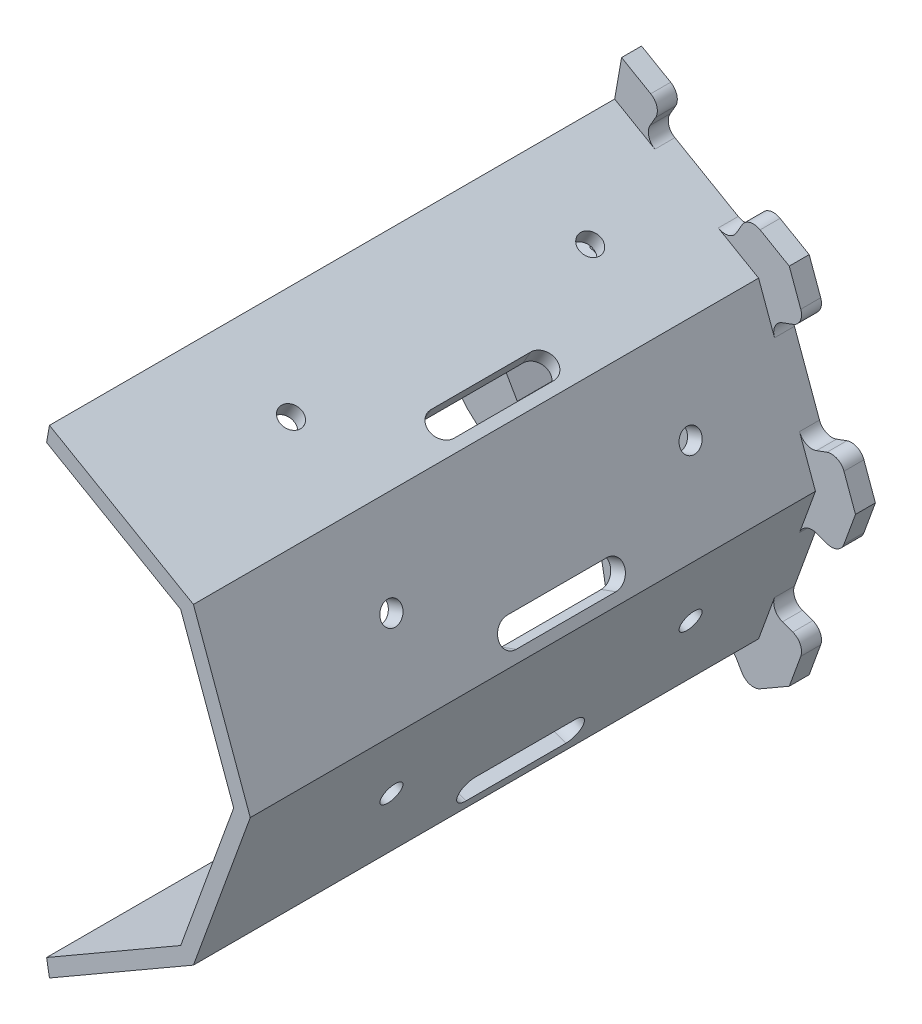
SolidWorks part; units mm, degrees
ref_plane "Front Plane" through (0, 0, 0) normal (0, 0, 1) x (1, 0, 0)
ref_plane "Top Plane" through (0, 0, 0) normal (0, 1, 0) x (1, 0, 0)
ref_plane "Right Plane" through (0, 0, 0) normal (1, 0, 0) x (0, 0, -1)
sketch "Sketch1" plane through (0, 0, 0) normal (0, 0, 1) x (1, 0, 0)
  line L1 (36.5476, 0) -> (27.9971, 23.4923)
  line L2 (27.9971, 23.4923) -> (6.3464, 35.9923)
  line L3 (6.3464, 35.9923) -> (-18.2738, 31.6511)
  line L4 (-18.2738, 31.6511) -> (-34.3435, 12.5)
  line L5 (-34.3435, 12.5) -> (-34.3435, -12.5)
  line L6 (-34.3435, -12.5) -> (-18.2738, -31.6511)
  line L7 (-18.2738, -31.6511) -> (6.3464, -35.9923)
  line L8 (6.3464, -35.9923) -> (27.9971, -23.4923)
  line L9 (27.9971, -23.4923) -> (36.5476, 0)
  circle A0 centre (0, 0) radius 34.3435 construction
extrude "Boss-Extrude1" add sketch "Sketch1" along normal blind 85
sketch "Sketch2" plane through (0, 0, 85) normal (0, 0, 1) x (1, 0, 0)
  line L1 (34.0537, 0) -> (26.0866, 21.8893)
  line L2 (26.0866, 21.8893) -> (5.9134, 33.5363)
  line L3 (5.9134, 33.5363) -> (-17.0268, 29.4914)
  line L4 (-17.0268, 29.4914) -> (-32, 11.647)
  line L5 (-32, 11.647) -> (-32, -11.647)
  line L6 (-32, -11.647) -> (-17.0268, -29.4914)
  line L7 (-17.0268, -29.4914) -> (5.9134, -33.5363)
  line L8 (5.9134, -33.5363) -> (26.0866, -21.8893)
  line L9 (26.0866, -21.8893) -> (34.0537, 0)
  circle A0 centre (0, 0) radius 32 construction
extrude "Cut-Extrude1" cut sketch "Sketch2" against normal through all
sketch "Sketch3" plane through (17.1717, 29.7423, 0) normal (0.5, 0.866, 0) x (0.866, -0.5, 0)
  circle A0 centre (0, -14.5) radius 1.65
  circle A1 centre (0, -59.5) radius 1.65
extrude "Cut-Extrude2" cut sketch "Sketch3" against normal up to next
sketch "Sketch4" plane through (32.2723, 11.7462, 0) normal (0.9397, 0.342, 0) x (0, 0, -1)
  circle A0 centre (-14.5, 0) radius 1.65
  circle A1 centre (-59.5, 0) radius 1.65
extrude "Cut-Extrude6" cut sketch "Sketch4" against normal up to next
sketch "Sketch5" plane through (32.2723, -11.7462, 0) normal (0.9397, -0.342, 0) x (0, 0, -1)
  circle A0 centre (-14.5, 0) radius 1.65
  circle A1 centre (-59.5, 0) radius 1.65
extrude "Cut-Extrude7" cut sketch "Sketch5" against normal up to next
sketch "Sketch6" plane through (17.1717, -29.7423, 0) normal (0.5, -0.866, 0) x (0.866, 0.5, 0)
  circle A0 centre (0, 14.5) radius 1.65
  circle A1 centre (0, 59.5) radius 1.65
extrude "Cut-Extrude8" cut sketch "Sketch6" against normal up to next
sketch "Sketch7" plane through (0, 0, 0) normal (0, 0, -1) x (-1, 0, 0)
  line L1 (40, 14.5588) -> (21.2836, 36.8642)
  line L2 (21.2836, 36.8642) -> (-7.3917, 41.9204)
  line L3 (-7.3917, 41.9204) -> (-32.6083, 27.3616)
  line L4 (-32.6083, 27.3616) -> (-42.5671, 0)
  line L5 (-42.5671, 0) -> (-32.6083, -27.3616)
  line L6 (-32.6083, -27.3616) -> (-7.3917, -41.9204)
  line L7 (-7.3917, -41.9204) -> (21.2836, -36.8642)
  line L8 (21.2836, -36.8642) -> (40, -14.5588)
  line L9 (40, -14.5588) -> (40, 14.5588)
  circle A0 centre (0, 0) radius 40 construction
extrude "Boss-Extrude2" add sketch "Sketch7" along normal blind 3
sketch "Sketch8" plane through (0, 0, 0) normal (0, 0, 1) x (1, 0, 0)
  circle A0 centre (0, 0) radius 15
extrude "Boss-Extrude3" add sketch "Sketch8" along normal blind 5
sketch "Sketch9" plane through (0, 0, 5) normal (0, 0, 1) x (1, 0, 0)
  line L1 (6.58, 0) -> (3.29, 5.6984)
  line L2 (3.29, 5.6984) -> (-3.29, 5.6984)
  line L3 (-3.29, 5.6984) -> (-6.58, 0)
  line L4 (-6.58, 0) -> (-3.29, -5.6984)
  line L5 (-3.29, -5.6984) -> (3.29, -5.6984)
  line L6 (3.29, -5.6984) -> (6.58, 0)
  circle A0 centre (0, 0) radius 5.6984 construction
extrude "Cut-Extrude9" cut sketch "Sketch9" against normal blind 6
sketch "Sketch10" plane through (0, 0, -1) normal (0, 0, 1) x (1, 0, 0)
  circle A0 centre (0, 0) radius 3.5
extrude "Cut-Extrude10" cut sketch "Sketch10" against normal up to next
sketch "Sketch12" plane through (0, 0, 0) normal (0, 0, 1) x (1, 0, 0)
  line L1 (7.3917, 41.9204) -> (32.6083, 27.3616) construction
  line L2 (26.4952, 30.891) -> (23.6669, 25.9923)
  line L3 (27.9971, 23.4923) -> (6.3464, 35.9923) construction
  line L4 (23.6669, 25.9923) -> (10.6765, 33.4923)
  line L5 (27.9971, 23.4923) -> (6.3464, 35.9923) construction
  line L6 (10.6765, 33.4923) -> (13.5048, 38.391)
  line L7 (13.5048, 38.391) -> (26.4952, 30.891)
extrude "Cut-Extrude12" cut sketch "Sketch12" against normal up to next
fillet "Fillet1" radius 2 4 edges at (13.5048, 38.391, -1.5) (10.6765, 33.4923, -1.5) (26.4952, 30.891, -1.5) (23.6669, 25.9923, -1.5)
sketch "Sketch13" plane through (0, 0, 0) normal (0, 0, 1) x (1, 0, 0)
  line L1 (32.6083, 27.3616) -> (42.5671, 0) construction
  line L2 (40.1529, 6.6331) -> (34.8375, 4.6985)
  line L3 (36.5476, 0) -> (27.9971, 23.4923) construction
  line L4 (34.8375, 4.6985) -> (29.7072, 18.7939)
  line L5 (29.7072, 18.7939) -> (35.0226, 20.7285)
  line L6 (35.0226, 20.7285) -> (40.1529, 6.6331)
extrude "Cut-Extrude13" cut sketch "Sketch13" against normal up to next
sketch "Sketch14" plane through (0, 0, 0) normal (0, 0, 1) x (1, 0, 0)
  line L0 (37.5877, -13.6808) -> (35.0226, -20.7285)
  line L1 (42.5671, 0) -> (32.6083, -27.3616) construction
  line L2 (35.0226, -20.7285) -> (29.7072, -18.7939)
  line L3 (27.9971, -23.4923) -> (36.5476, 0) construction
  line L4 (29.7072, -18.7939) -> (34.8375, -4.6985)
  line L5 (27.9971, -23.4923) -> (36.5476, 0) construction
  line L6 (34.8375, -4.6985) -> (40.1529, -6.6331)
  line L7 (40.1529, -6.6331) -> (37.5877, -13.6808)
extrude "Cut-Extrude14" cut sketch "Sketch14" against normal up to next
sketch "Sketch15" plane through (0, 0, 0) normal (0, 0, 1) x (1, 0, 0)
  line L0 (20, -34.641) -> (13.5048, -38.391)
  line L1 (32.6083, -27.3616) -> (7.3917, -41.9204) construction
  line L2 (13.5048, -38.391) -> (10.6765, -33.4923)
  line L3 (6.3464, -35.9923) -> (27.9971, -23.4923) construction
  line L4 (10.6765, -33.4923) -> (23.6669, -25.9923)
  line L5 (6.3464, -35.9923) -> (27.9971, -23.4923) construction
  line L6 (23.6669, -25.9923) -> (26.4952, -30.891)
  line L7 (26.4952, -30.891) -> (20, -34.641)
extrude "Cut-Extrude15" cut sketch "Sketch15" against normal up to next
fillet "Fillet2" radius 2 12 edges at (13.5048, -38.391, -1.5) (10.6765, -33.4923, -1.5) (23.6669, -25.9923, -1.5) (26.4952, -30.891, -1.5) (35.0226, -20.7285, -1.5) (29.7072, -18.7939, -1.5) (34.8375, -4.6985, -1.5) (40.1529, -6.6331, -1.5) (40.1529, 6.6331, -1.5) (34.8375, 4.6985, -1.5) (29.7072, 18.7939, -1.5) (35.0226, 20.7285, -1.5)
sketch "Sketch16" plane through (17.1717, 29.7423, 0) normal (0.5, 0.866, 0) x (0.866, -0.5, 0)
  line L0 (9, -44.5) -> (9, -29.5) construction
  line L1 (7, -44.5) -> (7, -29.5)
  line L2 (11, -44.5) -> (11, -29.5)
  arc A0 (7, -44.5) -> (11, -44.5) centre (9, -44.5) ccw
  arc A1 (11, -29.5) -> (7, -29.5) centre (9, -29.5) ccw
  point P2 (9, -37)
extrude "Cut-Extrude16" cut sketch "Sketch16" against normal up to next
sketch "Sketch17" plane through (32.2723, 11.7462, 0) normal (0.9397, 0.342, 0) x (0, 0, -1)
  line L0 (-44.5, -9) -> (-29.5, -9) construction
  line L1 (-44.5, -7) -> (-29.5, -7)
  line L2 (-44.5, -11) -> (-29.5, -11)
  arc A0 (-44.5, -7) -> (-44.5, -11) centre (-44.5, -9) ccw
  arc A1 (-29.5, -11) -> (-29.5, -7) centre (-29.5, -9) ccw
  point P2 (-37, -9)
extrude "Cut-Extrude17" cut sketch "Sketch17" against normal up to next
sketch "Sketch18" plane through (32.2723, -11.7462, 0) normal (0.9397, -0.342, 0) x (0, 0, -1)
  line L0 (-44.5, -9) -> (-29.5, -9) construction
  line L2 (-44.5, -7) -> (-29.5, -7)
  line L3 (-44.5, -11) -> (-29.5, -11)
  arc A0 (-44.5, -7) -> (-44.5, -11) centre (-44.5, -9) ccw
  arc A1 (-29.5, -11) -> (-29.5, -7) centre (-29.5, -9) ccw
  point P4 (-37, -9)
extrude "Cut-Extrude18" cut sketch "Sketch18" against normal up to next
sketch "Sketch19" plane through (17.1717, -29.7423, 0) normal (0.5, -0.866, 0) x (0.866, 0.5, 0)
  line L0 (-9, 44.5) -> (-9, 29.5) construction
  line L2 (-7, 44.5) -> (-7, 29.5)
  line L3 (-11, 44.5) -> (-11, 29.5)
  arc A0 (-7, 44.5) -> (-11, 44.5) centre (-9, 44.5) ccw
  arc A1 (-11, 29.5) -> (-7, 29.5) centre (-9, 29.5) ccw
  point P4 (-9, 37)
extrude "Cut-Extrude19" cut sketch "Sketch19" against normal up to next
sketch "Sketch20" plane through (0, 0, 5) normal (0, 0, 1) x (1, 0, 0)
  text T0 "40"
extrude "Cut-Extrude20" cut sketch "Sketch20" against normal blind 1
sketch "Sketch21" plane through (0, 0, 0) normal (0, 0, 1) x (1, 0, 0)
  line L0 (7.3917, 41.9204) -> (6.3464, 35.9923)
  line L1 (6.3464, 35.9923) -> (2.6047, 14.7721)
  line L2 (7.3917, -41.9204) -> (2.6047, -14.7721)
  circle A0 centre (0, 0) radius 15 construction
  circle A1 centre (0, 0) radius 15 construction
  arc A2 (2.6047, 14.7721) -> (2.6047, -14.7721) centre (0, 0) ccw
split "Split3" trim tools "Sketch21" bodies to split 121 resulting bodies 125
